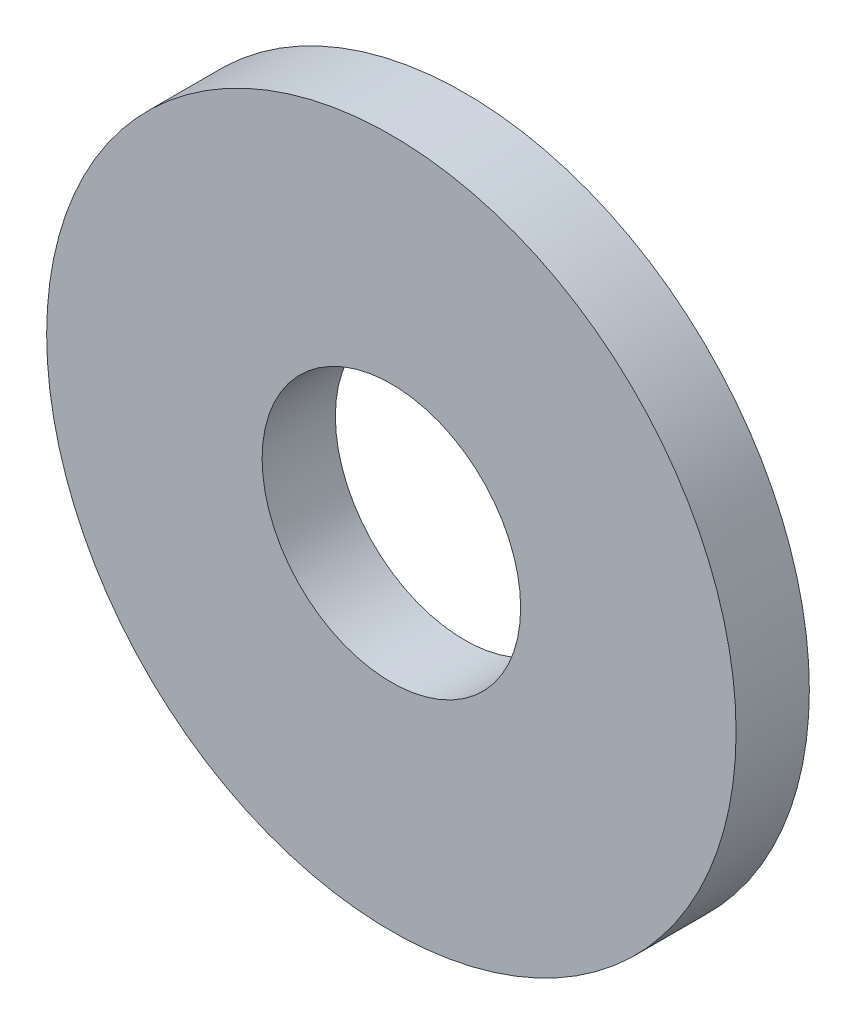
SolidWorks part; units mm, degrees
ref_plane "Plan de face" through (0, 0, 0) normal (0, 0, 1) x (1, 0, 0)
ref_plane "Plan de dessus" through (0, 0, 0) normal (0, 1, 0) x (1, 0, 0)
ref_plane "Plan de droite" through (0, 0, 0) normal (1, 0, 0) x (0, 0, -1)
sketch "Esquisse1" plane through (0, 0, 0) normal (0, 0, 1) x (1, 0, 0)
  circle A0 centre (0, 0) radius 4
  circle A1 centre (0, 0) radius 1.5
extrude "Extrusion1" add sketch "Esquisse1" along normal blind 0.85
